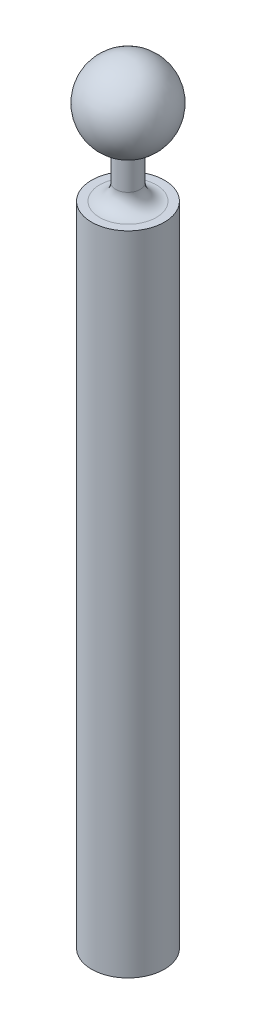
SolidWorks part; units mm, degrees
ref_plane "Plan de face" through (0, 0, 0) normal (0, 0, 1) x (1, 0, 0)
ref_plane "Plan de dessus" through (0, 0, 0) normal (0, 1, 0) x (1, 0, 0)
ref_plane "Plan de droite" through (0, 0, 0) normal (1, 0, 0) x (0, 0, -1)
sketch "Esquisse1" plane through (0, 0, 0) normal (0, 1, 0) x (1, 0, 0)
  circle A0 centre (0, 0) radius 9
  dimension "D1" = 18
extrude "Boss.-Extru.1" add sketch "Esquisse1" along normal blind 160
sketch "Esquisse2" plane through (0, 160, 0) normal (0, 1, 0) x (1, 0, 0)
  circle A0 centre (0, 0) radius 3
  dimension "D1" = 6
extrude "Boss.-Extru.2" add sketch "Esquisse2" along normal blind 15
sketch "Esquisse3" plane through (0, 0, 0) normal (0, 0, 1) x (1, 0, 0)
  line L0 (0, 160) -> (0, 227.0691) construction
  line L1 (9, 160) -> (-9, 160) construction
  line L2 (0, 160) -> (0, 0) construction
  line L3 (0, 175) -> (0, 160) construction
  line L4 (3, 175) -> (-3, 175) construction
  line L5 (0, 171) -> (0, 191)
  arc A0 (0, 171) -> (0, 191) centre (0, 181) ccw
  dimension "D1" = 10
  dimension "D2" = 6
revolve "Révolution1" add sketch "Esquisse3" angle 360 about L0
fillet "Congé1" radius 4 1 edges at (0, 160, 3)
